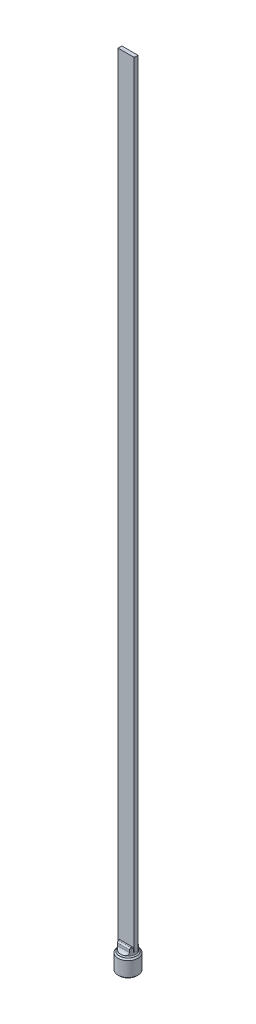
SolidWorks part; units mm, degrees
other "Cut-Extrude1"
ref_plane "Front Plane" through (0, 0, 0) normal (0, 0, 1) x (1, 0, 0)
ref_plane "Top Plane" through (0, 0, 0) normal (0, 1, 0) x (1, 0, 0)
ref_plane "Right Plane" through (0, 0, 0) normal (1, 0, 0) x (0, 0, -1)
imported_body "Imported1"
sketch "Sketch1" plane through (0, 8.001, 0) normal (0, 1, 0) x (1, 0, 0)
  line L0 (-3.0261, 0.7239) -> (3.0261, 0.7239)
  line L1 (3.0261, -0.7239) -> (-3.0261, -0.7239)
  line L2 (2.7643, 0.7239) -> (-2.7643, 0.7239) construction
  line L3 (-2.7643, -0.7239) -> (2.7643, -0.7239) construction
  arc A0 (-3.0261, 0.7239) -> (-3.0261, -0.7239) centre (0, 0) ccw
  arc A1 (3.0261, -0.7239) -> (3.0261, 0.7239) centre (0, 0) ccw
  dimension "D1" = 6.223
extrude "Boss-Extrude1" add sketch "Sketch1" along normal offset from surface (296.799 mm away) 304.8
